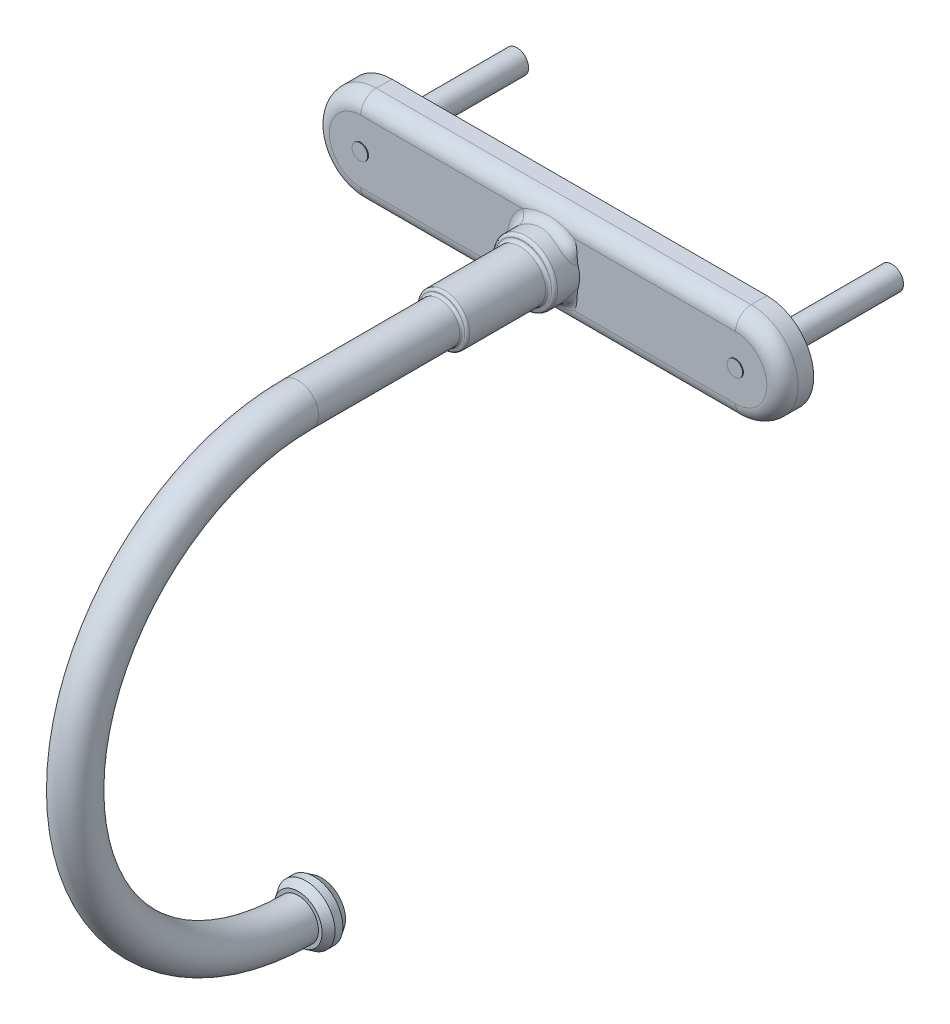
SolidWorks part; units mm, degrees
ref_plane "Front" through (0, 0, 0) normal (0, 0, 1) x (1, 0, 0)
ref_plane "Top" through (0, 0, 0) normal (0, 1, 0) x (1, 0, 0)
ref_plane "Right" through (0, 0, 0) normal (1, 0, 0) x (0, 0, -1)
sketch "Sketch1" plane through (0, 0, 0) normal (0, 0, 1) x (1, 0, 0)
  line L0 (-76.2, 0) -> (76.2, 0) construction
  line L1 (-76.2, 19.05) -> (76.2, 19.05)
  line L2 (-76.2, 19.05) -> (-76.2, -19.05) construction
  line L3 (-76.2, -19.05) -> (76.2, -19.05)
  line L4 (76.2, 19.05) -> (76.2, -19.05) construction
  arc A0 (-76.2, 19.05) -> (-76.2, -19.05) centre (-76.2, 0) ccw
  arc A1 (76.2, -19.05) -> (76.2, 19.05) centre (76.2, 0) ccw
  point P6 (0, 0)
  dimension "D1" = 152.4
  dimension "D2" = 38.1
extrude "Base-Extrude" add sketch "Sketch1" along normal blind 12.7
sketch "Sketch2" plane through (0, 0, 0) normal (0, 0, -1) x (-1, 0, 0)
  line L0 (-76.2, 4.7625) -> (76.2, 4.7625) construction
  line L1 (-76.2, 0) -> (76.2, 0) construction
  circle A0 centre (76.2, 0) radius 4.7625
  circle A1 centre (-76.2, 0) radius 4.7625
  arc A2 (76.2, -19.05) -> (76.2, 19.05) centre (76.2, 0) ccw construction
  circle A3 centre (76.2, 0) radius 3.175
  circle A4 centre (-76.2, 0) radius 3.175
  dimension "D1" = 9.525
  dimension "D2" = 6.35
  dimension "D3" = 6.35
extrude "Boss-Extrude1" add sketch "Sketch2" along normal blind 50.8
sketch "Sketch3" plane through (0, 0, 0) normal (1, 0, 0) x (0, 0, -1)
  line L0 (-12.7, 19.05) -> (-12.7, -19.05) construction
  line L1 (-12.7, 19.05) -> (-12.7, -19.05) construction
  line L2 (-12.7, -1.7599) -> (-114.3, -1.7599)
  line L3 (-114.3, -1.7599) -> (-114.3, -179.5599) construction
  arc A0 (-114.3, -1.7599) -> (-114.3, -179.5599) centre (-114.3, -90.6599) ccw
  dimension "D1" = 177.8
  dimension "D2" = 101.6
sketch "Sketch4" plane through (0, 0, 12.7) normal (0, 0, 1) x (1, 0, 0)
  circle A0 centre (0, 0) radius 8.255
  circle A1 centre (0, 0) radius 4.7625
  dimension "D1" = 9.525
  dimension "D2" = 16.51
sweep "Boss-Sweep1" add profiles "Sketch4" path "Sketch3"
fillet "Fillet1" radius 6.35 4 edges at (95.25, 0, 12.7) (0, 19.05, 12.7) (-95.25, 0, 12.7) (0, -19.05, 12.7)
sketch "Sketch6" plane through (0, 0, 12.7) normal (0, 0, 1) x (1, 0, 0)
  circle A0 centre (0, 0) radius 4.7625
  circle A1 centre (0, 0) radius 12.7818
  dimension "D1" = 9.525
extrude "Boss-Extrude2" add sketch "Sketch6" along normal blind 10.16
sketch "Sketch7" plane through (0, 0, 22.86) normal (0, 0, 1) x (1, 0, 0)
  circle A0 centre (0, 0) radius 10.2999
  circle A1 centre (0, 0) radius 4.7625
  dimension "D1" = 9.525
extrude "Boss-Extrude3" add sketch "Sketch7" along normal blind 33.02
fillet "Fillet3" radius 1.2319 2 edges at (12.7818, 0, 22.86) (10.2999, 0, 22.86)
fillet "Fillet4" radius 3.7719
fillet "Fillet11" radius 1.016 2 edges at (10.2999, 0, 55.88) (8.255, 0, 55.88)
sketch "Sketch8" plane through (0, 0, 114.3) normal (0, 0, -1) x (-1, 0, 0)
  circle A3 centre (0, -181.3197) radius 9.7208
ref_plane "Plane1" through (0, 0, 104.775) normal (0, 0, -1) x (-1, 0, 0)
sketch "Sketch9" plane through (0, 0, 104.775) normal (0, 0, -1) x (-1, 0, 0)
  circle A2 centre (0, -181.3197) radius 9.7208 construction
  circle A3 centre (0, -181.3197) radius 9.7208
ref_plane "Plane3" through (0, 0, 111.125) normal (0, 0, -1) x (-1, 0, 0)
ref_plane "Plane4" through (0, 0, 107.95) normal (0, 0, -1) x (-1, 0, 0)
sketch "Sketch12" plane through (0, 0, 107.95) normal (0, 0, -1) x (-1, 0, 0)
  circle A0 centre (0, -181.3197) radius 9.7208 construction
  circle A1 centre (0, -181.3197) radius 9.7208 construction
  circle A2 centre (0, -181.3197) radius 11.8025
sketch "Sketch13" plane through (0, 0, 111.125) normal (0, 0, -1) x (-1, 0, 0)
  circle A0 centre (0, -181.3197) radius 11.8025 construction
  circle A1 centre (0, -181.3197) radius 11.8025
loft "Boss-Loft2" add profiles "Sketch8", "Sketch13"
sketch "Sketch14" plane through (0, 0, 111.125) normal (0, 0, -1) x (-1, 0, 0)
  circle A0 centre (0, -181.3197) radius 11.8025 construction
  circle A1 centre (0, -181.3197) radius 11.8025
extrude "Boss-Extrude4" add sketch "Sketch14" along normal blind 3.175
loft "Boss-Loft3" add profiles "Sketch12", "Sketch9"
sketch "Sketch15" plane through (0, 0, 104.775) normal (0, 0, -1) x (-1, 0, 0)
  circle A0 centre (0, -181.3197) radius 4.7625
  circle A1 centre (0, -181.3197) radius 9.7208 construction
  dimension "D1" = 9.525
extrude "Cut-Extrude1" cut sketch "Sketch15" against normal up to surface (9.525 mm away)
sketch "Sketch16" plane through (0, 0, 12.7) normal (0, 0, 1) x (1, 0, 0)
  circle A3 centre (-76.2, 0) radius 3.175 construction
  circle A4 centre (-76.2, 0) radius 3.175
  circle A5 centre (76.2, 0) radius 3.175 construction
  circle A6 centre (76.2, 0) radius 3.175
extrude "Boss-Extrude5" add sketch "Sketch16" along normal blind 0.3175
